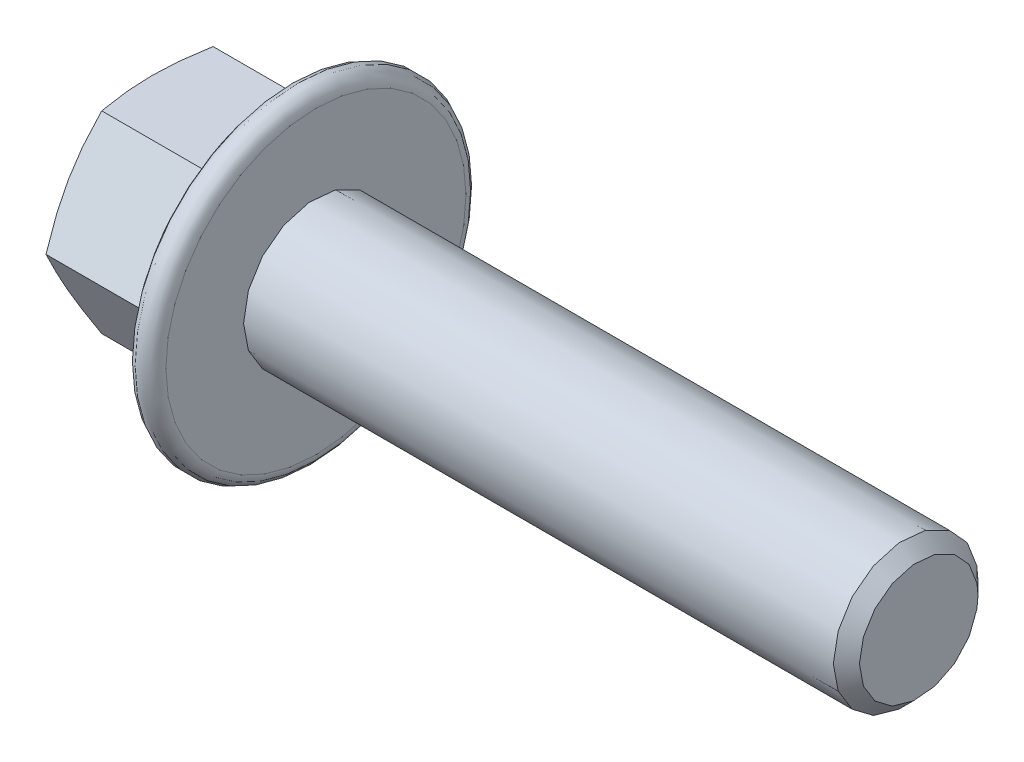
SolidWorks part; units mm, degrees
ref_plane "Front" through (0, 0, 0) normal (0, 0, 1) x (1, 0, 0)
ref_plane "Top" through (0, 0, 0) normal (0, 1, 0) x (1, 0, 0)
ref_plane "Right" through (0, 0, 0) normal (1, 0, 0) x (0, 0, -1)
other "Configuration Table"
sketch "Sketch1" plane through (0, 0, 0) normal (1, 0, 0) x (0, 0, -1)
  line L1 (2.3094, -4) -> (4.6188, 0)
  line L2 (4.6188, 0) -> (2.3094, 4)
  line L3 (2.3094, 4) -> (-2.3094, 4)
  line L4 (-2.3094, 4) -> (-4.6188, 0)
  line L5 (-4.6188, 0) -> (-2.3094, -4)
  line L6 (-2.3094, -4) -> (2.3094, -4)
  circle A0 centre (0, 0) radius 4 construction
  dimension "s" = 8
extrude "BaseHead" add sketch "Sketch1" along normal blind 6.8
ref_plane "Plane1" through (12.8, 0, 0) normal (1, 0, 0) x (0, 0, -1)
sketch "Sketch2" plane through (6.8, 0, 0) normal (1, 0, 0) x (0, 0, -1)
  circle A0 centre (0, 0) radius 3
extrude "BaseBody" add sketch "Sketch2" along normal blind 25
sketch "Sketch3" plane through (2.5556, 0, 2.0632) normal (0, 1, 0) x (0, 0, -1)
  line L0 (6.682, 2.5556) -> (6.682, 2.3303)
  line L2 (6.682, 2.3303) -> (6.0632, 2.5556)
  line L4 (6.0632, 2.5556) -> (6.682, 2.5556)
  line L5 (2.0632, 3.5448) -> (2.0632, 2.0587) construction
  dimension "D1" = 20
  dimension "da" = 8
revolve "HeadChamfer" cut sketch "Sketch3" angle 360 about L5
sketch "Sketch5" plane through (-3.1384, 0, 9.9384) normal (0, 1, 0) x (0, 0, -1)
  line L0 (9.9384, -9.9384) -> (9.9384, -13.5308) construction
  line L1 (14.5572, -9.9384) -> (12.2478, -9.9384) construction
  line L2 (9.9384, -9.9384) -> (16.1614, -9.9384)
  line L3 (16.4052, -8.8384) -> (9.9384, -5.8229)
  line L4 (9.9384, -5.8229) -> (9.9384, -9.9384)
  line L5 (9.9384, -34.9384) -> (9.9384, -9.9384) construction
  arc A0 (16.1614, -9.9384) -> (16.4052, -8.8384) centre (16.1614, -9.3614) ccw
  dimension "D3" = 25
  dimension "c" = 1.1
  dimension "dc" = 13.6
revolve "Revolve1" add sketch "Sketch5" angle 360 about L0
fillet "HeadFillet" [suppressed] radius 0.25
fillet "FlangeHexFillet" radius 0.4 6 edges at (4.6158, -1.0695, -4.0013) (4.6158, 2.9305, -2.9269) (4.6158, -2.9305, 2.9269) (4.6158, 1.0695, 4.0013)
chamfer "Chamfer1" distance 0.5415 angle 45 1 edges at (31.8, 0, -3)
sketch "Sketch6" plane through (0, 0, 0) normal (0, 0, 1) x (1, 0, 0)
  line L0 (30.717, 3.5415) -> (31.2585, 3.5415)
  line L1 (31.2585, 3.5415) -> (31.2585, 3)
  line L2 (31.2585, 3) -> (30.9877, 2.531)
  line L3 (30.9877, 2.531) -> (30.717, 3)
  line L4 (30.717, 3) -> (30.717, 3.5415)
  line L5 (31.2585, 3) -> (6.8, 3) construction
revolve "Cut-Revolve10" [suppressed] cut sketch "Sketch6" angle 360
pattern_linear "LPattern10" [suppressed] count 29
equation "\"b@ThreadCosmetic1\" = \"l@BaseBody\" - \"lg@Plane1\""
equation "\"D1@Chamfer1\" = (  \"d@Sketch2\" - \"D2@ThreadCosmetic1\" )  / 2"
equation "\"D1@Sketch6\" = (  \"d@Sketch2\" - \"D2@ThreadCosmetic1\" )  / 2"
equation "\"pitch@LPattern10\" = 1.2 * \"D1@Sketch6\""
equation "\"D1@LPattern10\" = \"b@ThreadCosmetic1\" / \"pitch@LPattern10\""
